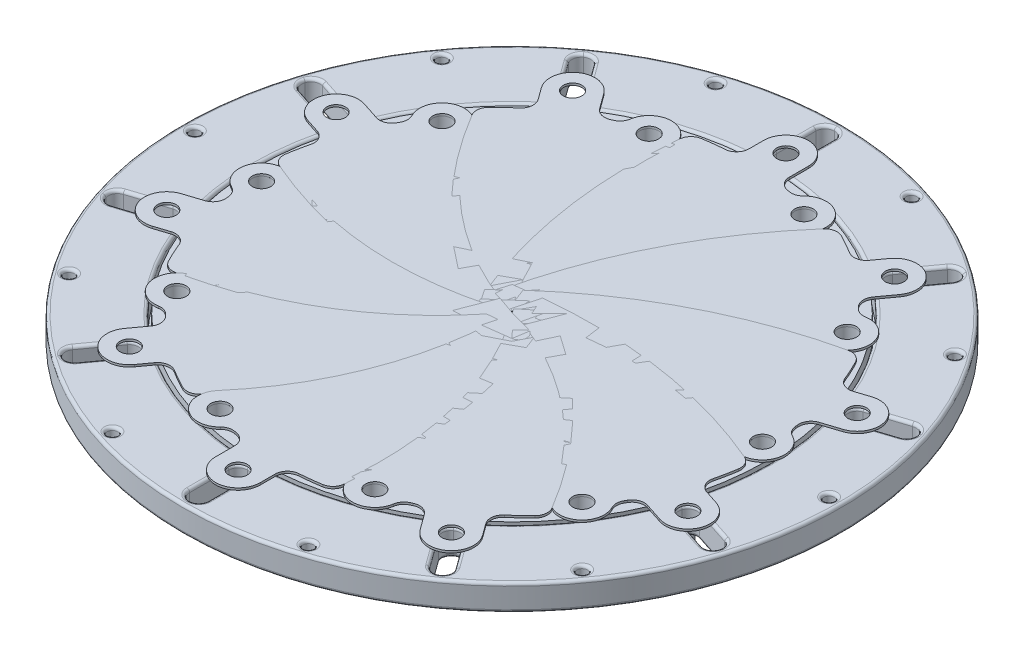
SolidWorks part; units mm, degrees
ref_plane "Front" through (0, 0, 0) normal (0, 0, 1) x (1, 0, 0)
ref_plane "Top" through (0, 0, 0) normal (0, 1, 0) x (1, 0, 0)
ref_plane "Right" through (0, 0, 0) normal (1, 0, 0) x (0, 0, -1)
sketch "Sketch1" plane through (0, 0, 0) normal (0, 1, 0) x (1, 0, 0)
  line L0 (0, 31.25) -> (0, 40) construction
  circle A0 centre (0, 0) radius 31.25
  circle A1 centre (0, 0) radius 40
  point P9 (0, 35.625)
  dimension "D1" = 62.5
  dimension "D2" = 80
extrude "Boss-Extrude1" add sketch "Sketch1" along normal mid plane 3.175
sketch "Sketch2" plane through (0, 1.5875, 0) normal (0, 1, 0) x (1, 0, 0)
  line L0 (0, 31.25) -> (0, 40) construction
  line L1 (0, 39.125) -> (0, 32.125)
  circle A0 centre (0, 0) radius 31.25 construction
  circle A1 centre (0, 0) radius 40 construction
  point P10 (0, 35.625)
  dimension "D1" = 7
extrude "Cut-Extrude-Thin1" cut sketch "Sketch2" against normal blind 3.175 and the other way through all thin
fillet "Fillet1" radius 1.125 4 edges at (1.125, 0, -32.125) (1.125, 0, -39.125) (-1.125, 0, -32.125) (-1.125, 0, -39.125)
pattern_circular "CirPattern1" count 10 over 360 about axis through (0, 0, 0) along (0, 1, 0) of "Cut-Extrude-Thin1", "Fillet1"
sketch "Sketch3" plane through (0, 0, 0) normal (0, 1, 0) x (1, 0, 0)
  circle A0 centre (0, 0) radius 31.25 construction
  circle A1 centre (0, 0) radius 31.25 construction
  circle A2 centre (0, 0) radius 30.925
  circle A3 centre (0, 0) radius 26.925
  dimension "D1" = 0.325
  dimension "D2" = 4
extrude "Boss-Extrude2" add sketch "Sketch3" along normal mid plane 3.175 separate body
sketch "Sketch4" plane through (0, 1.5875, 0) normal (0, 1, 0) x (1, 0, 0)
  line L0 (0, 26.925) -> (0, 30.925) construction
  line L1 (0, 33.25) -> (0, 38) construction
  circle A0 centre (0, 0) radius 26.925 construction
  circle A1 centre (0, 0) radius 30.925 construction
  circle A2 centre (0, 0) radius 28.925 construction
  point P10 (0, 28.925)
sketch "Sketch5" plane through (0, 1.5875, 0) normal (0, 1, 0) x (1, 0, 0)
  line L0 (0, 32.9229) -> (7.4931, 27.9376)
  line L1 (0, 33.25) -> (0, 38) construction
  line L2 (7.4931, 27.9376) -> (-1.9099, 0.0554)
  line L3 (-1.9099, 0.0554) -> (0, 32.9229)
  circle A0 centre (0, 0) radius 28.925 construction
  dimension "D1" = 105
  dimension "D2" = 9
  dimension "D3" = 29.425
hole_wizard "M2 Clearance Hole1" positions "Sketch7" profile "Sketch8" hole size "M2" standard "ANSI Metric"
sketch "Sketch7" plane through (0, 1.5875, 0) normal (0, 1, 0) x (1, 0, 0)
  point P0 (7.4931, 27.9376)
sketch "Sketch8" plane through (7.4931, 1.5875, -27.9376) normal (1, 0, 0) x (0, 0, 1)
  line L0 (0, 0) -> (0, 3.176)
  line L1 (0, 3.176) -> (1.1, 3.176)
  line L2 (1.1, 3.176) -> (1.1, 0)
  line L5 (1.1, 0) -> (0, 0)
  line L11 (0, -6.35) -> (0, 107.95) construction
  dimension "Thru Hole Dia." = 2.2
  dimension "Thru Hole Depth" = 3.176
sketch "Sketch9" plane through (0, 1.5875, 0) normal (0, 1, 0) x (1, 0, 0)
  line L0 (-1.9099, 0.0554) -> (0, 32.9229) construction
  line L1 (-1.9099, 0.0554) -> (0, 32.9229) construction
  line L2 (-1.9099, 0.0554) -> (18.9542, 25.5231) construction
  line L3 (-1.9099, 0.0554) -> (29.9391, 8.3956) construction
  line L4 (-1.9099, 0.0554) -> (28.7587, -11.9176) construction
  line L5 (-1.9099, 0.0554) -> (15.8639, -27.6575) construction
  line L6 (-1.9099, 0.0554) -> (-3.8198, -32.812) construction
  line L7 (-1.9099, 0.0554) -> (-22.774, -25.4122) construction
  line L8 (-1.9099, 0.0554) -> (-33.7588, -8.2847) construction
  line L9 (-1.9099, 0.0554) -> (-32.5785, 12.0284) construction
  line L10 (-1.9099, 0.0554) -> (-19.6837, 27.7683) construction
  line L11 (2.7125, 33.25) -> (2.7125, 29.6972)
  line L12 (-2.7125, 33.25) -> (-2.7125, 30.0447)
  line L13 (-2.7125, 30.0447) -> (-2.7125, 28.8544)
  line L14 (21.341, 24.1934) -> (19.2527, 21.3192)
  line L15 (16.9521, 27.3822) -> (15.068, 24.789)
  line L16 (15.068, 24.789) -> (14.3684, 23.826)
  line L17 (31.0884, 5.917) -> (27.7095, 4.8191)
  line L18 (29.412, 11.0764) -> (26.3636, 10.086)
  line L19 (26.3636, 10.086) -> (25.2315, 9.7181)
  line L20 (28.2316, -14.5984) -> (24.8527, -13.5005)
  line L21 (29.908, -9.4389) -> (26.8596, -8.4484)
  line L22 (26.8596, -8.4484) -> (25.7276, -8.0806)
  line L23 (13.8618, -29.5165) -> (11.7735, -26.6422)
  line L24 (18.2507, -26.3278) -> (16.3667, -23.7346)
  line L25 (16.3667, -23.7346) -> (15.667, -22.7716)
  line L26 (-6.5323, -33.1391) -> (-6.5323, -29.5863)
  line L27 (-1.1073, -33.1391) -> (-1.1073, -29.9338)
  line L28 (-1.1073, -29.9338) -> (-1.1073, -28.7435)
  line L29 (-25.1608, -24.0825) -> (-23.0725, -21.2083)
  line L30 (-20.7718, -27.2713) -> (-18.8878, -24.6781)
  line L31 (-18.8878, -24.6781) -> (-18.1882, -23.7152)
  line L32 (-34.9082, -5.8061) -> (-31.5293, -4.7082)
  line L33 (-33.2318, -10.9656) -> (-30.1834, -9.9751)
  line L34 (-30.1834, -9.9751) -> (-29.0513, -9.6072)
  line L35 (-32.0514, 14.7093) -> (-28.6725, 13.6114)
  line L36 (-33.7278, 9.5498) -> (-30.6794, 8.5593)
  line L37 (-30.6794, 8.5593) -> (-29.5473, 8.1915)
  line L38 (-17.6816, 29.6274) -> (-15.5933, 26.7531)
  line L39 (-22.0705, 26.4386) -> (-20.1865, 23.8455)
  line L40 (-20.1865, 23.8455) -> (-19.4868, 22.8825)
  circle A0 centre (0, 33.25) radius 2.7125
  arc A2 (-1.9099, 0.0554) -> (0, 32.9229) centre (22.2652, 15.1398) cw
  circle A3 centre (7.4931, 27.9376) radius 2.7125
  circle A4 centre (0, 0) radius 26.925 construction
  arc A5 (-1.9099, 0.0554) -> (38.3081, 42.5608) centre (46.7912, -5.7453) cw
  arc A6 (-1.9099, 0.0554) -> (32.4227, 5.717) centre (18.9593, -19.5686) cw
  arc A7 (-1.9099, 0.0554) -> (28.512, -16.4614) centre (2.7472, -27.6419) cw
  arc A8 (-1.9099, 0.0554) -> (11.2603, -30.9374) centre (-15.2658, -23.9147) cw
  arc A9 (-1.9099, 0.0554) -> (-11.2603, -30.9374) centre (-27.2965, -9.1924) cw
  arc A10 (-1.9099, 0.0554) -> (-28.512, -16.4614) centre (-26.8436, 10.5326) cw
  arc A11 (-1.9099, 0.0554) -> (-32.4227, 5.717) centre (-13.023, 25.2166) cw
  arc A12 (-1.9099, 0.0554) -> (-21.1624, 25.2204) centre (6.9521, 26.7824) cw
  circle A13 centre (19.1465, 25.7878) radius 2.7125
  arc A16 (0, 32.125) -> (1.125, 33.25) centre (0, 33.25) ccw construction
  circle A17 centre (0, 33.25) radius 1.125
  circle A18 centre (7.4931, 27.9376) radius 1.125
  circle A19 centre (-1.9099, 0.0554) radius 30
  circle A20 centre (22.086, 17.0856) radius 2.7125
  circle A21 centre (19.1465, 25.7878) radius 1.125
  circle A22 centre (22.086, 17.0856) radius 1.125
  arc A23 (-1.9099, 0.0554) -> (55.6112, 10.8035) centre (34.0805, -33.2632) cw
  circle A24 centre (30.2502, 8.4967) radius 2.7125
  circle A25 centre (27.5133, -0.2713) radius 2.7125
  circle A26 centre (30.2502, 8.4967) radius 1.125
  circle A27 centre (27.5133, -0.2713) radius 1.125
  arc A28 (-1.9099, 0.0554) -> (50.9432, -25.0592) centre (7.6227, -48.0546) cw
  circle A29 centre (29.0698, -12.0187) radius 2.7125
  circle A30 centre (21.7019, -17.5034) radius 2.7125
  circle A31 centre (29.0698, -12.0187) radius 1.125
  circle A32 centre (21.7019, -17.5034) radius 1.125
  arc A33 (-1.9099, 0.0554) -> (26.0871, -51.329) centre (-22.4762, -44.4695) cw
  circle A34 centre (16.0562, -27.9221) radius 2.7125
  circle A35 centre (6.8716, -28.0286) radius 2.7125
  circle A36 centre (16.0562, -27.9221) radius 1.125
  circle A37 centre (6.8716, -28.0286) radius 1.125
  arc A38 (-1.9099, 0.0554) -> (-9.4629, -57.9717) centre (-44.7195, -23.8774) cw
  circle A39 centre (-3.8198, -33.1391) radius 2.7125
  circle A40 centre (-11.3129, -27.8267) radius 2.7125
  circle A41 centre (-3.8198, -33.1391) radius 1.125
  circle A42 centre (-11.3129, -27.8267) radius 1.125
  arc A43 (-1.9099, 0.0554) -> (-42.1279, -42.4499) centre (-50.611, 5.8562) cw
  circle A44 centre (-22.9663, -25.6769) radius 2.7125
  circle A45 centre (-25.9058, -16.9747) radius 2.7125
  circle A46 centre (-22.9663, -25.6769) radius 1.125
  circle A47 centre (-25.9058, -16.9747) radius 1.125
  arc A48 (-1.9099, 0.0554) -> (-59.431, -10.6926) centre (-37.9003, 33.3741) cw
  circle A49 centre (-34.07, -8.3858) radius 2.7125
  circle A50 centre (-31.3331, 0.3822) radius 2.7125
  circle A51 centre (-34.07, -8.3858) radius 1.125
  circle A52 centre (-31.3331, 0.3822) radius 1.125
  arc A53 (-1.9099, 0.0554) -> (-54.763, 25.1701) centre (-11.4425, 48.1655) cw
  circle A54 centre (-32.8896, 12.1295) radius 2.7125
  circle A55 centre (-25.5217, 17.6143) radius 2.7125
  circle A56 centre (-32.8896, 12.1295) radius 1.125
  circle A57 centre (-25.5217, 17.6143) radius 1.125
  arc A58 (-1.9099, 0.0554) -> (-29.9069, 51.4399) centre (18.6564, 44.5804) cw
  circle A59 centre (-19.876, 28.033) radius 2.7125
  circle A60 centre (-10.6914, 28.1395) radius 2.7125
  circle A61 centre (-19.876, 28.033) radius 1.125
  circle A62 centre (-10.6914, 28.1395) radius 1.125
  arc A63 (-1.9099, 0.0554) -> (5.6431, 58.0826) centre (40.8997, 23.9883) cw
  point P13 (-1.9099, 0.0554)
  point P36 (0, 0)
  point P187 (-1.9099, 0.0554)
  dimension "D2" = 10
  dimension "D3" = 1.5875
  dimension "D5" = 60
  dimension "D4" = 1.5875
  dimension "D1" = 10
extrude "Boss-Extrude3" add sketch "Sketch9" along normal blind 0.254 separate body
sketch "Sketch10" plane through (0, 1.8415, 0) normal (0, 1, 0) x (1, 0, 0)
  line L2 (2.7125, 29.6972) -> (2.7125, 33.25)
  line L3 (-2.7125, 33.25) -> (-2.7125, 30.0447)
  line L4 (2.7125, 29.6972) -> (2.7125, 33.25)
  line L5 (-2.7125, 33.25) -> (-2.7125, 30.0447)
  arc A1 (-7.839, 29.4637) -> (0.812, -8.222) centre (50.1775, 22.9461) ccw
  arc A3 (-7.839, 29.4637) -> (-1.9099, 0.0554) centre (40.8997, 23.9883) ccw construction
  arc A4 (9.5527, 26.1723) -> (0.812, -8.222) centre (39.9147, 0.1487) ccw
  arc A5 (9.5527, 26.1723) -> (-1.9099, 0.0554) centre (46.7912, -5.7453) ccw construction
  arc A12 (2.7125, 33.25) -> (-2.7125, 33.25) centre (0, 33.25) ccw
  arc A13 (-2.7125, 30.0447) -> (-7.839, 29.4637) centre (-1.9099, 0.0554) ccw
  arc A14 (-7.839, 29.4637) -> (-1.9099, 0.0554) centre (40.8997, 23.9883) ccw
  arc A15 (9.5527, 26.1723) -> (-1.9099, 0.0554) centre (46.7912, -5.7453) ccw
  arc A16 (9.5527, 26.1723) -> (5.105, 29.2238) centre (7.4931, 27.9376) ccw
  arc A17 (5.105, 29.2238) -> (2.7125, 29.6972) centre (-1.9099, 0.0554) ccw
  arc A18 (2.7125, 33.25) -> (-2.7125, 33.25) centre (0, 33.25) ccw
  arc A19 (-2.7125, 30.0447) -> (-7.839, 29.4637) centre (-1.9099, 0.0554) ccw
  arc A20 (-7.839, 29.4637) -> (-1.9099, 0.0554) centre (40.8997, 23.9883) ccw
  arc A21 (9.5527, 26.1723) -> (-1.9099, 0.0554) centre (46.7912, -5.7453) ccw
  arc A22 (9.5527, 26.1723) -> (5.105, 29.2238) centre (7.4931, 27.9376) ccw
  arc A23 (5.105, 29.2238) -> (2.7125, 29.6972) centre (-1.9099, 0.0554) ccw
  dimension "D1" = 0
extrude "Boss-Extrude4" add sketch "Sketch10" against normal up to surface (0.254 mm away) contours A4 A1 M15 M14
fillet "Fillet2" radius 1 1 edges at (0.812, 1.7145, 8.222)
fillet "Fillet3" radius 1.5 4 edges at (-2.7125, 1.7145, -30.0447) (2.7125, 1.7145, -29.6972) (5.105, 1.7145, -29.2238) (-7.839, 1.7145, -29.4637)
sketch "Sketch11" plane through (0, 1.5875, 0) normal (0, 1, 0) x (1, 0, 0)
  circle A0 centre (7.4931, 27.9376) radius 1.125 construction
  circle A1 centre (7.4931, 27.9376) radius 1.125
  circle A2 centre (22.4834, 18.1976) radius 1.125
  circle A3 centre (28.8857, 1.5068) radius 1.125
  circle A4 centre (24.2547, -15.7596) radius 1.125
  circle A5 centre (10.3592, -27.0063) radius 1.125
  circle A6 centre (-7.4931, -27.9376) radius 1.125
  circle A7 centre (-22.4834, -18.1976) radius 1.125
  circle A8 centre (-28.8857, -1.5068) radius 1.125
  circle A9 centre (-24.2547, 15.7596) radius 1.125
  circle A10 centre (-10.3592, 27.0063) radius 1.125
  point P23 (0, 0)
  dimension "D1" = 10
extrude "Cut-Extrude1" cut sketch "Sketch11" against normal through all
sketch "Sketch13" plane through (0, -1.5875, 0) normal (0, -1, 0) x (1, 0, 0)
  line L0 (1.5068, 28.8857) -> (0, 0) construction
  arc A0 (-7.4931, 27.9376) -> (10.3592, 27.0063) centre (0, 0) cw construction
  circle A1 centre (10.3592, 27.0063) radius 1.125 construction
  circle A2 centre (1.4807, 28.3864) radius 1.5
  circle A3 centre (17.8831, 22.0947) radius 1.5
  circle A4 centre (27.4547, 7.3636) radius 1.5
  circle A5 centre (26.5395, -10.1802) radius 1.5
  circle A6 centre (15.4872, -23.8354) radius 1.5
  circle A7 centre (-1.4807, -28.3864) radius 1.5
  circle A8 centre (-17.8831, -22.0947) radius 1.5
  circle A9 centre (-27.4547, -7.3636) radius 1.5
  circle A10 centre (-26.5395, 10.1802) radius 1.5
  circle A11 centre (-15.4872, 23.8354) radius 1.5
  circle A12 centre (0, 0) radius 26.925 construction
  point P29 (0, 0)
  dimension "D1" = 3
  dimension "D2" = 10
extrude "Boss-Extrude5" add sketch "Sketch13" along normal blind 7 contours A2 | A4 | A6 | A8 | A10
sketch "Sketch15" plane through (0, -1.5875, 0) normal (0, -1, 0) x (1, 0, 0)
  circle A0 centre (0, 0) radius 29.925 construction
  circle A1 centre (0, 0) radius 30.925
  circle A2 centre (0, 0) radius 30.925
  circle A3 centre (0, 0) radius 30.225
  dimension "D2" = 0.3
  dimension "D1" = 0
extrude "Cut-Extrude2" cut sketch "Sketch15" against normal blind 1
sketch "Sketch16" plane through (0, -1.5875, 0) normal (0, -1, 0) x (1, 0, 0)
  circle A1 centre (0, 0) radius 31.25
  circle A4 centre (0, 0) radius 30.475
  circle A5 centre (0, 0) radius 30.475
  dimension "D1" = 0.25
extrude "Boss-Extrude7" add sketch "Sketch16" against normal offset from surface (0.75 mm away) 0.25
sketch "Sketch17" plane through (0, -1.5875, 0) normal (0, -1, 0) x (1, 0, 0)
  circle A0 centre (-38.49, 0) radius 0.635
  circle A1 centre (0, 0) radius 39.125 construction
  circle A2 centre (-31.1391, 22.6239) radius 0.635
  circle A3 centre (-11.8941, 36.6062) radius 0.635
  circle A4 centre (11.8941, 36.6062) radius 0.635
  circle A5 centre (31.1391, 22.6239) radius 0.635
  circle A6 centre (38.49, 0) radius 0.635
  circle A7 centre (31.1391, -22.6239) radius 0.635
  circle A8 centre (11.8941, -36.6062) radius 0.635
  circle A9 centre (-11.8941, -36.6062) radius 0.635
  circle A10 centre (-31.1391, -22.6239) radius 0.635
  point P26 (0, 0)
  dimension "D1" = 1.27
  dimension "D2" = 10
extrude "Cut-Extrude3" cut sketch "Sketch17" against normal through all
fillet "Fillet5" radius 0.2 10 edges at (15.4872, -8.5875, -25.3354) (27.4547, -8.5875, 5.8636) (1.4807, -8.5875, 26.8864) (-26.5395, -8.5875, 8.6802) (-17.8831, -8.5875, -23.5947) (-26.5395, -1.5875, 8.6802) (27.4547, -1.5875, 5.8636) (15.4872, -1.5875, -25.3354) (1.4807, -1.5875, 26.8864) (-17.8831, -1.5875, -23.5947)
fillet "Fillet6" radius 0.35 144 edges at (0, -1.5875, 40) (21.85, 1.5875, -28.16) (21.85, -1.5875, -28.16) (20.0297, -1.5875, -29.4825) (20.0297, 1.5875, -29.4825) (19.7198, -1.5875, -25.7887) (19.7198, 1.5875, -25.7887) (23.447, -1.5875, -30.9186) (23.447, 1.5875, -30.9186) (18.4327, -1.5875, -26.7238) (18.4327, 1.5875, -26.7238) (22.1599, -1.5875, -31.8538) (22.1599, 1.5875, -31.8538) (34.229, 1.5875, -9.9388) (34.229, -1.5875, -9.9388) (33.5337, -1.5875, -12.0787) (33.5337, 1.5875, -12.0787) (31.1119, -1.5875, -9.2724) (31.1119, 1.5875, -9.2724) (37.1425, -1.5875, -11.2319) (37.1425, 1.5875, -11.2319) (30.6202, -1.5875, -10.7856) (30.6202, 1.5875, -10.7856) (36.6509, -1.5875, -12.745) (36.6509, 1.5875, -12.745) (33.5337, 1.5875, 12.0787) (33.5337, -1.5875, 12.0787) (34.229, -1.5875, 9.9388) (34.229, 1.5875, 9.9388) (30.6202, -1.5875, 10.7856) (30.6202, 1.5875, 10.7856) (36.6509, -1.5875, 12.745) (36.6509, 1.5875, 12.745) (31.1119, -1.5875, 9.2724) (31.1119, 1.5875, 9.2724) (37.1425, -1.5875, 11.2319) (37.1425, 1.5875, 11.2319) (20.0297, 1.5875, 29.4825) (20.0297, -1.5875, 29.4825) (21.85, -1.5875, 28.16) (21.85, 1.5875, 28.16) (18.4327, -1.5875, 26.7238) (18.4327, 1.5875, 26.7238) (22.1599, -1.5875, 31.8538) (22.1599, 1.5875, 31.8538) (19.7198, -1.5875, 25.7887) (19.7198, 1.5875, 25.7887) (23.447, -1.5875, 30.9186) (23.447, 1.5875, 30.9186) (-1.125, 1.5875, 35.625) (-1.125, -1.5875, 35.625) (1.125, -1.5875, 35.625) (1.125, 1.5875, 35.625) (-0.7955, -1.5875, 32.4545) (-0.7955, 1.5875, 32.4545) (-0.7955, -1.5875, 38.7955) (-0.7955, 1.5875, 38.7955) (0.7955, -1.5875, 32.4545) (0.7955, 1.5875, 32.4545) (0.7955, -1.5875, 38.7955) (0.7955, 1.5875, 38.7955) (1.125, 1.5875, -35.625) (-21.85, 1.5875, 28.16) (-21.85, -1.5875, 28.16) (1.125, -1.5875, -35.625) (-20.0297, -1.5875, 29.4825) (-20.0297, 1.5875, 29.4825) (-19.7198, -1.5875, 25.7887) (-19.7198, 1.5875, 25.7887) (-23.447, -1.5875, 30.9186) (-23.447, 1.5875, 30.9186) (-18.4327, -1.5875, 26.7238) (-18.4327, 1.5875, 26.7238) (-22.1599, -1.5875, 31.8538) (-22.1599, 1.5875, 31.8538) (-34.229, 1.5875, 9.9388) (-1.125, -1.5875, -35.625) (-34.229, -1.5875, 9.9388) (-33.5337, -1.5875, 12.0787) (-33.5337, 1.5875, 12.0787) (-31.1119, -1.5875, 9.2724) (-31.1119, 1.5875, 9.2724) (-37.1425, -1.5875, 11.2319) (-37.1425, 1.5875, 11.2319) (-30.6202, -1.5875, 10.7856) (-1.125, 1.5875, -35.625) (-30.6202, 1.5875, 10.7856) (-36.6509, -1.5875, 12.745) (-36.6509, 1.5875, 12.745) (-33.5337, 1.5875, -12.0787) (-33.5337, -1.5875, -12.0787) (-34.229, -1.5875, -9.9388) (-34.229, 1.5875, -9.9388) (0.7955, -1.5875, -32.4545) (-30.6202, -1.5875, -10.7856) (-30.6202, 1.5875, -10.7856) (-36.6509, -1.5875, -12.745) (-36.6509, 1.5875, -12.745) (-31.1119, -1.5875, -9.2724) (-31.1119, 1.5875, -9.2724) (-37.1425, -1.5875, -11.2319) (-37.1425, 1.5875, -11.2319) (0.7955, 1.5875, -32.4545) (0.7955, -1.5875, -38.7955) (0.7955, 1.5875, -38.7955) (-0.7955, -1.5875, -32.4545) (-20.0297, 1.5875, -29.4825) (-20.0297, -1.5875, -29.4825) (-0.7955, 1.5875, -32.4545) (-21.85, -1.5875, -28.16) (-21.85, 1.5875, -28.16) (-18.4327, -1.5875, -26.7238) (-18.4327, 1.5875, -26.7238) (-22.1599, -1.5875, -31.8538) (-0.7955, -1.5875, -38.7955) (-22.1599, 1.5875, -31.8538) (-19.7198, -1.5875, -25.7887) (-19.7198, 1.5875, -25.7887) (-23.447, -1.5875, -30.9186) (-23.447, 1.5875, -30.9186) (-0.7955, 1.5875, -38.7955) (0, -1.5875, -30.475) (-38.49, 1.5875, 0.635) (-38.49, -1.5875, -0.635) (-31.1391, 1.5875, 23.2589) (-31.1391, -1.5875, 21.9889) (-11.8941, 1.5875, 37.2412) (-11.8941, -1.5875, 35.9712) (11.8941, 1.5875, 37.2412) (11.8941, -1.5875, 35.9712) (0, 1.5875, 40) (31.1391, 1.5875, 23.2589) (31.1391, -1.5875, 21.9889) (38.49, 1.5875, 0.635) (38.49, -1.5875, -0.635) (31.1391, 1.5875, -21.9889) (31.1391, -1.5875, -23.2589) (11.8941, 1.5875, -35.9712) (11.8941, -1.5875, -37.2412) (-11.8941, 1.5875, -35.9712) (-11.8941, -1.5875, -37.2412) (-31.1391, 1.5875, -21.9889) (-31.1391, -1.5875, -23.2589) (0, 1.5875, 31.25)
other "Save Bodies1"
pattern_circular "CirPattern2" count 10 over 360 about axis through (0, 0, 0) along (0, 1, 0)
sketch "Sketch18"
sketch_block_instance "Block1-1"
sketch_block "Block1"
